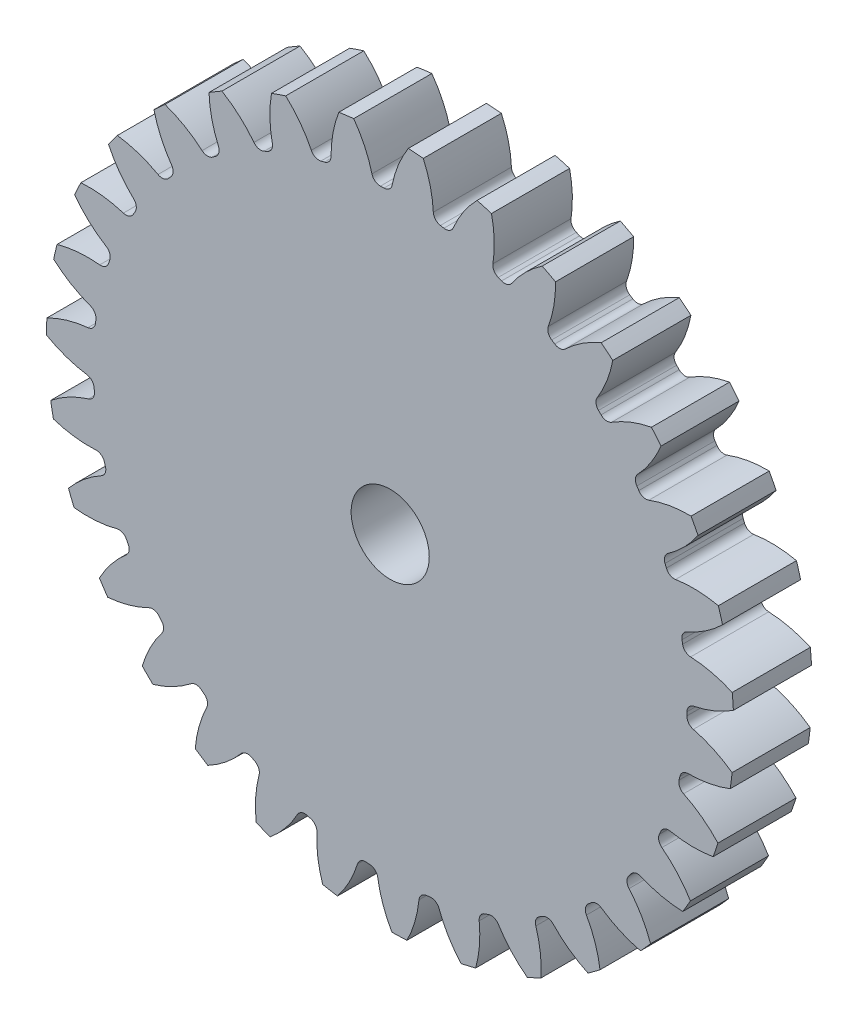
SolidWorks part; units mm, degrees
ref_plane "Front" through (0, 0, 0) normal (0, 0, 1) x (1, 0, 0)
ref_plane "Top" through (0, 0, 0) normal (0, 1, 0) x (1, 0, 0)
ref_plane "Right" through (0, 0, 0) normal (1, 0, 0) x (0, 0, -1)
sketch "Sketch3" plane through (0, 0, 0) normal (0, 0, 1) x (1, 0, 0)
  circle A0 centre (0, 0) radius 558.8
  dimension "od" = 1117.6
extrude "gearBody" add sketch "Sketch3" along normal blind 127
sketch "Sketch2" plane through (0, 0, 0) normal (0, 0, 1) x (1, 0, 0)
  line L0 (0, 0) -> (455.7276, 188.7685) construction
  line L1 (556.6551, -58.2547) -> (0, 0) construction
  line L2 (0, 0) -> (36.3143, 0) construction
  line L3 (524.747, 13.9844) -> (523.483, -38.9947) construction
  line L5 (524.115, -12.5052) -> (0, 0) construction
  line L7 (0, 0) -> (493.276, 0) construction
  arc A0 (493.2542, 4.6356) -> (492.4718, -28.1546) centre (0, 0) ccw construction
  arc A1 (557.9352, 31.0765) -> (555.8182, -57.6502) centre (0, 0) ccw construction
  arc A2 (524.747, 13.9844) -> (523.483, -38.9947) centre (0, 0) ccw construction
  arc A3 (482.3834, -14.4576) -> (482.524, -8.5647) centre (0, 0) ccw
  arc A4 (556.6551, -58.2547) -> (492.7472, -28.2248) centre (446.2062, -210.2883) ccw
  arc A5 (556.6551, -58.2547) -> (558.8, 31.6404) centre (0, 0) ccw
  arc A6 (558.8, 31.6404) -> (493.5326, 4.6926) centre (455.7276, 188.7685) cw
  arc A7 (482.524, -8.5647) -> (493.5326, 4.6926) centre (496.3056, -8.8094) cw
  arc A8 (492.7472, -28.2248) -> (482.3834, -14.4576) centre (496.1609, -14.8705) cw
  point P6 (558.8, 31.6404)
  point P22 (556.6551, -58.2547)
  dimension "baseDia" = 986.552
  dimension "od" = 1117.6
  dimension "pd" = 1049.8667
  dimension "rd" = 965.2
  dimension "rFillet" = 13.7837
  dimension "pointX" = 558.8
  dimension "pointY" = 31.6404
  dimension "CTT" = 52.9791
  dimension "flankCenterAngle" = 22.5
extrude "toothCut" cut sketch "Sketch2" along normal through all
pattern_circular "CirPattern1" count 31 over 360 about axis through (0, 0, 0) along (0, 0, 1) of "toothCut"
sketch "hub1Dia" plane through (0, 0, 0) normal (0, 0, -1) x (-1, 0, 0)
  circle A0 centre (0, 0) radius 12.7
  dimension "hub1Dia" = 25.4
sketch "hub2Dia" plane through (0, 0, 127) normal (0, 0, 1) x (1, 0, 0)
  circle A0 centre (0, 0) radius 12.7
  dimension "hub2dia" = 25.4
sketch "boreDia" plane through (0, 0, 0) normal (0, 0, 1) x (1, 0, 0)
  circle A0 centre (0, 0) radius 63.5
  dimension "boreDia" = 127
extrude "bore" cut sketch "boreDia" against normal mid plane 25400
